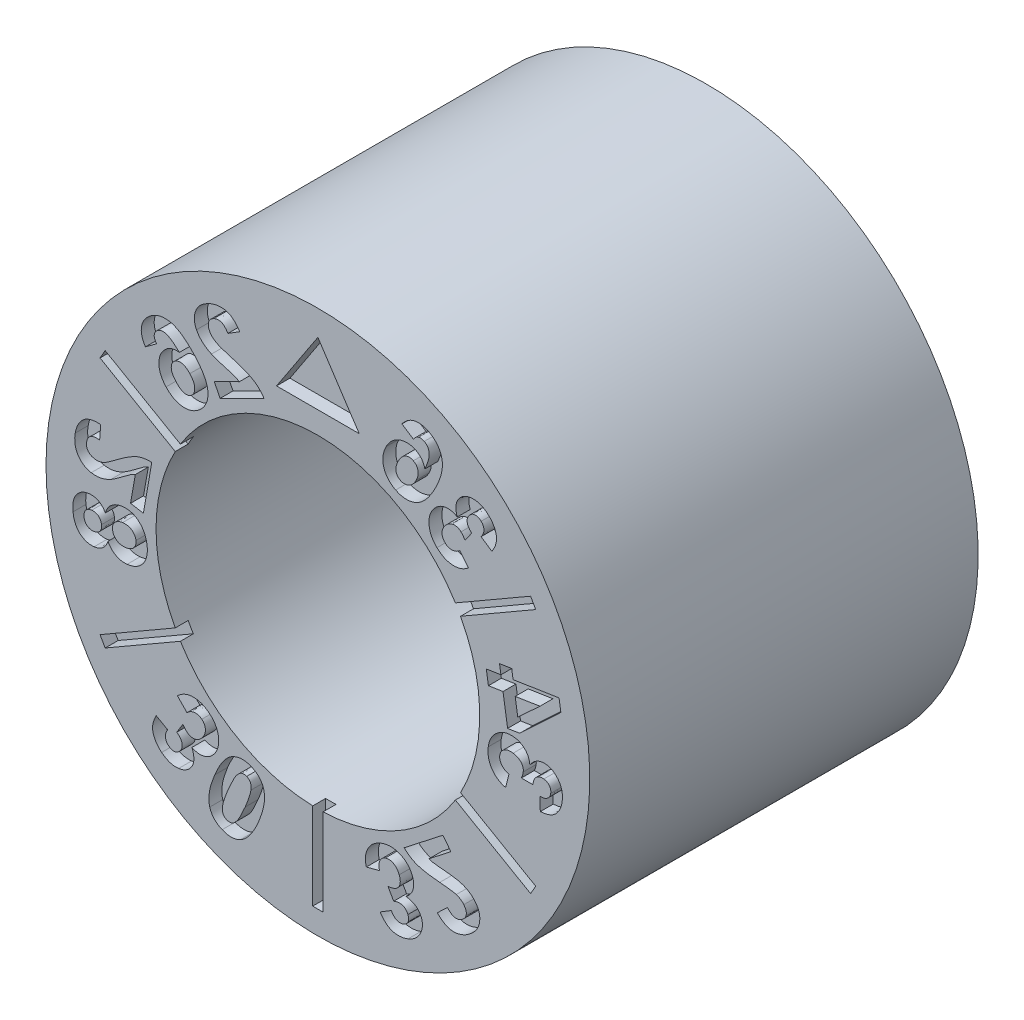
SolidWorks part; units mm, degrees
ref_plane "Front Plane" through (0, 0, 0) normal (0, 0, 1) x (1, 0, 0)
ref_plane "Top Plane" through (0, 0, 0) normal (0, 1, 0) x (1, 0, 0)
ref_plane "Right Plane" through (0, 0, 0) normal (1, 0, 0) x (0, 0, -1)
imported_body "Imported1"
other "DeleteFace1"
other "Move Face1" parameters "D1"=0.11
sketch "Sketch1" plane through (0, 0, 0) normal (0, 0, 1) x (1, 0, 0)
  line L0 (0, 0) -> (0, 2.2775) construction
  line L1 (0, 0) -> (1.1387, 1.9723) construction
  line L2 (0, 0) -> (1.9723, 1.1387) construction
  line L3 (0, 0) -> (2.2775, 0) construction
  line L4 (0, 0) -> (1.9723, -1.1387) construction
  line L5 (0, 0) -> (1.1387, -1.9723) construction
  line L6 (0, 0) -> (0, -2.2775) construction
  line L7 (0, 0) -> (-1.1387, -1.9723) construction
  line L8 (0, 0) -> (-1.9723, -1.1387) construction
  line L9 (0, 0) -> (-2.2775, 0) construction
  line L10 (0, 0) -> (-1.9723, 1.1387) construction
  line L11 (0, 0) -> (-1.1387, 1.9723) construction
  line L12 (-1.0592, -0.5654) -> (-1.0192, -0.6346)
  line L13 (-0.04, -1.2) -> (0.04, -1.2)
  line L14 (-0.04, -1.2) -> (-0.04, -1.92)
  line L15 (-0.04, -1.92) -> (0.04, -1.92)
  line L16 (0.04, -1.2) -> (0.04, -1.92)
  line L17 (-1.0192, -0.6346) -> (-1.6428, -0.9946)
  line L18 (-1.0592, -0.5654) -> (-1.6828, -0.9254)
  line L19 (-1.6828, -0.9254) -> (-1.6428, -0.9946)
  line L20 (-1.0192, 0.6346) -> (-1.0592, 0.5654)
  line L21 (-1.0592, 0.5654) -> (-1.6828, 0.9254)
  line L22 (-1.0192, 0.6346) -> (-1.6428, 0.9946)
  line L23 (-1.6428, 0.9946) -> (-1.6828, 0.9254)
  line L28 (1.0592, 0.5654) -> (1.0192, 0.6346)
  line L29 (1.0192, 0.6346) -> (1.6428, 0.9946)
  line L30 (1.0592, 0.5654) -> (1.6828, 0.9254)
  line L31 (1.6828, 0.9254) -> (1.6428, 0.9946)
  line L32 (1.0192, -0.6346) -> (1.0592, -0.5654)
  line L33 (1.0592, -0.5654) -> (1.6828, -0.9254)
  line L34 (1.0192, -0.6346) -> (1.6428, -0.9946)
  line L35 (1.6428, -0.9946) -> (1.6828, -0.9254)
  line L36 (0.04, 1.92) -> (-0.04, 1.92)
  line L37 (0.04, 1.2) -> (0.04, 1.92)
  line L38 (-0.04, 1.2) -> (-0.04, 1.92)
  line L39 (0.04, 1.2) -> (-0.04, 1.2)
  arc A0 (-0.3969, 1.2956) -> (0, 1.355) centre (0, 0) ccw construction
  text T0 "26   28    30    32    34   36" font "Arial" height 0.57
  point P18 (0, 0)
  point P44 (0, 0)
  dimension "D1" = 2.71
  dimension "D2" = 12
  dimension "D7" = 6
extrude "Cut-Extrude1" cut sketch "Sketch1" against normal blind 0.1
